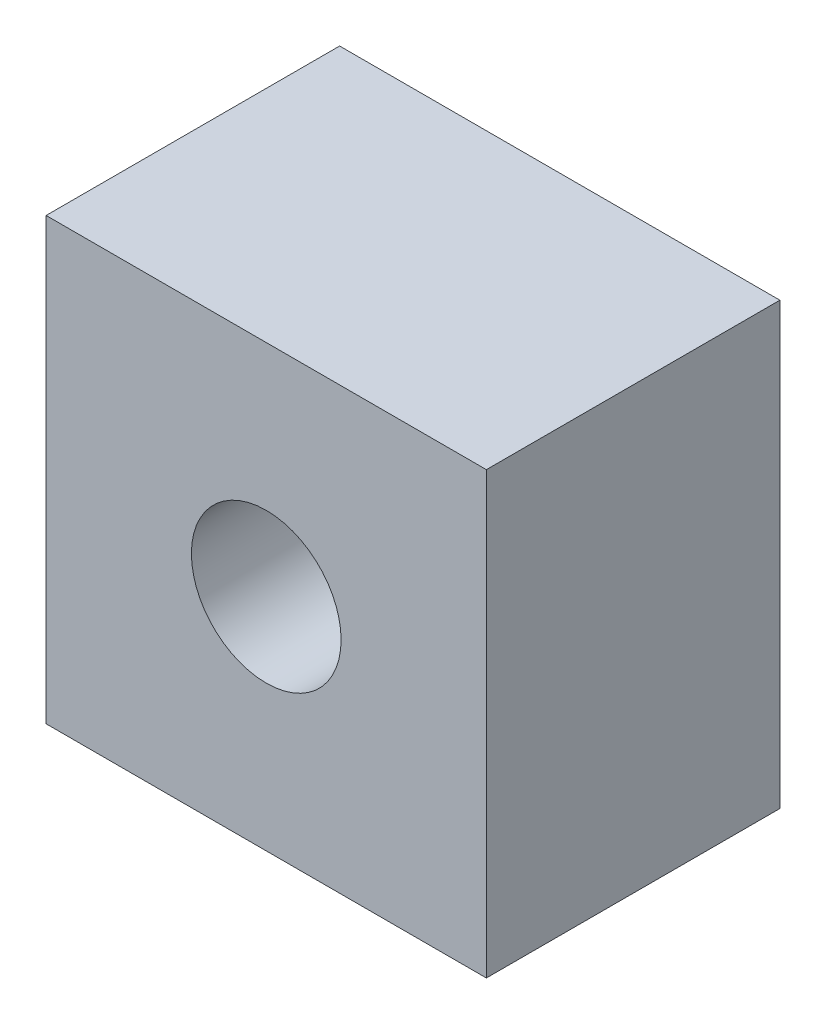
SolidWorks part; units mm, degrees
ref_plane "Plan de face" through (0, 0, 0) normal (0, 0, 1) x (1, 0, 0)
ref_plane "Plan de dessus" through (0, 0, 0) normal (0, 1, 0) x (1, 0, 0)
ref_plane "Plan de droite" through (0, 0, 0) normal (1, 0, 0) x (0, 0, -1)
sketch "Esquisse1" plane through (0, 0, 0) normal (0, 0, 1) x (1, 0, 0)
  line L1 (-15, -15) -> (15, -15)
  line L2 (-15, -15) -> (-15, 15)
  line L3 (-15, 15) -> (15, 15)
  line L4 (15, -15) -> (15, 15)
  dimension "D1" = 30
  dimension "D2" = 30
  dimension "D3" = 15
  dimension "D4" = 15
extrude "Extrusion1" add sketch "Esquisse1" along normal blind 20
hole_wizard "Trou taraudé M121" positions "Esquisse3" profile "Esquisse2" tap size "M12" standard "ISO"
sketch "Esquisse3" plane through (0, 0, 20) normal (0, 0, 1) x (1, 0, 0)
  point P0 (0, 0)
sketch "Esquisse2" plane through (0, 0, 20) normal (1, 0, 0) x (0, -1, 0)
  line L0 (0, 0) -> (0, 20)
  line L1 (0, 20) -> (5.1, 20)
  line L2 (5.1, 20) -> (5.1, 0)
  line L5 (5.1, 0) -> (0, 0)
  line L11 (0, -6.35) -> (0, 107.95) construction
  dimension "Diamètre du trou pour taraudage jusqu'au prochain" = 10.2
  dimension "Profondeur du trou pour taraudage jusqu'au prochain" = 20
